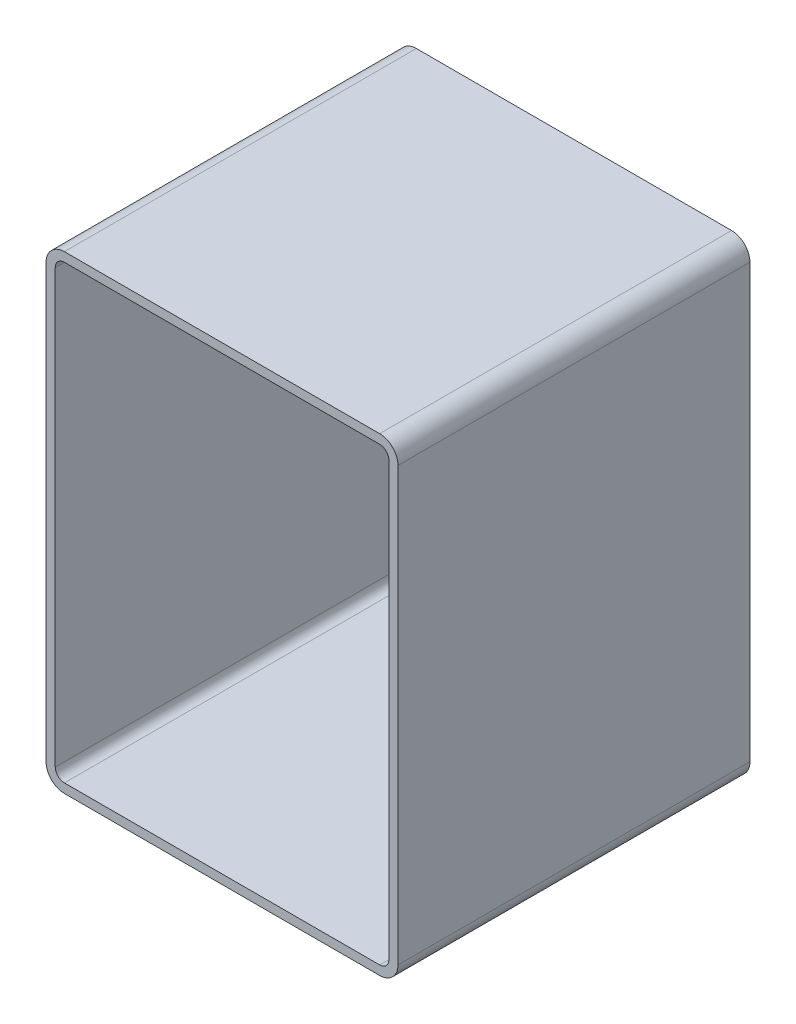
SolidWorks part; units mm, degrees
ref_plane "Front Plane" through (0, 0, 0) normal (0, 0, 1) x (1, 0, 0)
ref_plane "Top Plane" through (0, 0, 0) normal (0, 1, 0) x (1, 0, 0)
ref_plane "Right Plane" through (0, 0, 0) normal (1, 0, 0) x (0, 0, -1)
sketch "Sketch1" plane through (0, 0, 0) normal (0, 0, 1) x (1, 0, 0)
sketch_block_instance "HSS16x12x0.3125-1"
sketch_block "HSS16x12x0.3125"
extrude "Boss-Extrude1" add sketch "Sketch1" along normal blind 304.8
